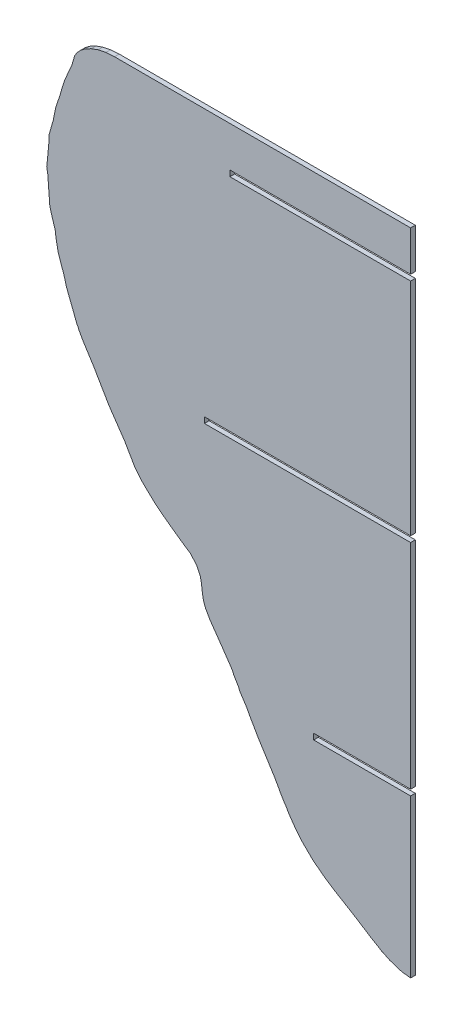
SolidWorks part; units mm, degrees
ref_plane "Спереди" through (0, 0, 0) normal (0, 0, 1) x (1, 0, 0)
ref_plane "Сверху" through (0, 0, 0) normal (0, 1, 0) x (1, 0, 0)
ref_plane "Справа" through (0, 0, 0) normal (1, 0, 0) x (0, 0, -1)
sketch "Model" plane through (0, 0, 0) normal (0, 0, 1) x (1, 0, 0)
  line L0 (-5553.9257, -52.95) -> (-5553.916, -52.9675)
  line L1 (-5553.916, -52.9675) -> (-5553.9072, -52.9834)
  line L2 (-5553.9072, -52.9834) -> (-5553.8984, -52.9993)
  line L3 (-5553.8984, -52.9993) -> (-5553.8896, -53.0151)
  line L4 (-5553.8896, -53.0151) -> (-5553.2595, -53.948)
  line L5 (-5553.2595, -53.948) -> (-5551.4807, -56.4991)
  line L6 (-5551.4807, -56.4991) -> (-5551.3896, -56.616)
  line L7 (-5551.3896, -56.616) -> (-5551.2983, -56.7328)
  line L8 (-5551.2983, -56.7328) -> (-5548.9946, -59.7252)
  line L9 (-5548.9946, -59.7252) -> (-5548.3706, -60.4646)
  line L10 (-5548.3706, -60.4646) -> (-5548.355, -60.4803)
  line L11 (-5548.355, -60.4803) -> (-5548.3496, -60.4855)
  line L12 (-5548.3496, -60.4855) -> (-5548.3105, -60.5317)
  line L13 (-5548.3105, -60.5317) -> (-5547.5281, -61.2947)
  line L14 (-5547.5281, -61.2947) -> (-5543.9182, -64.8505)
  line L15 (-5543.9182, -64.8505) -> (-5543.5627, -65.1965)
  line L16 (-5543.5627, -65.1965) -> (-5543.0049, -65.6568)
  line L17 (-5543.0049, -65.6568) -> (-5542.1001, -66.3395)
  line L18 (-5542.1001, -66.3395) -> (-5538.5322, -69.072)
  line L19 (-5538.5322, -69.072) -> (-5538.2622, -69.2579)
  line L20 (-5538.2622, -69.2579) -> (-5537.9922, -69.4437)
  line L21 (-5537.9922, -69.4437) -> (-5537.4724, -69.7801)
  line L22 (-5537.4724, -69.7801) -> (-5534.2546, -71.9145)
  line L23 (-5534.2546, -71.9145) -> (-5530.1741, -74.3404)
  line L24 (-5530.1741, -74.3404) -> (-5524.4228, -77.8417)
  line L25 (-5524.4228, -77.8417) -> (-5519.5566, -80.987)
  line L26 (-5519.5566, -80.987) -> (-5518.1645, -81.8527)
  line L27 (-5518.1645, -81.8527) -> (-5518.1201, -81.8767)
  line L28 (-5518.1201, -81.8767) -> (-5518.0757, -81.9007)
  line L29 (-5518.0757, -81.9007) -> (-5518.0315, -81.9247)
  line L30 (-5518.0315, -81.9247) -> (-5517.9871, -81.9487)
  line L31 (-5517.9871, -81.9487) -> (-5517.8228, -82.0496)
  line L32 (-5517.8228, -82.0496) -> (-5517.6584, -82.1503)
  line L33 (-5517.6584, -82.1503) -> (-5517.4985, -82.2342)
  line L34 (-5517.4985, -82.2342) -> (-5517.3386, -82.318)
  line L35 (-5517.3386, -82.318) -> (-5517.2012, -82.3906)
  line L36 (-5517.2012, -82.3906) -> (-5517.0637, -82.4631)
  line L37 (-5517.0637, -82.4631) -> (-5516.0979, -83.0245)
  line L38 (-5516.0979, -83.0245) -> (-5514.0706, -84.3211)
  line L39 (-5514.0706, -84.3211) -> (-5513.8103, -84.4079)
  line L40 (-5513.8103, -84.4079) -> (-5513.55, -84.4948)
  line L41 (-5513.55, -84.4948) -> (-5510.7139, -85.9042)
  line L42 (-5510.7139, -85.9042) -> (-5510.6553, -85.934)
  line L43 (-5510.6553, -85.934) -> (-5510.5964, -85.9637)
  line L44 (-5510.5964, -85.9637) -> (-5510.3667, -86.035)
  line L45 (-5510.3667, -86.035) -> (-5510.137, -86.1063)
  line L46 (-5510.137, -86.1063) -> (-5509.2903, -86.3835)
  line L47 (-5509.2903, -86.3835) -> (-5505.6423, -87.5591)
  line L48 (-5505.6423, -87.5591) -> (-5504.637, -87.7399)
  line L49 (-5504.637, -87.7399) -> (-5503.9382, -87.7903)
  line L50 (-5503.9382, -87.7903) -> (-5501.6404, -88.0699)
  line L51 (-5501.6404, -88.0699) -> (-5501.6404, -20.5677)
  line L52 (-5501.6404, -20.5677) -> (-5543.1523, -20.5677)
  line L53 (-5543.1523, -20.5677) -> (-5543.1523, -20.3177)
  line L54 (-5543.1523, -20.3177) -> (-5543.1523, -18.3177)
  line L55 (-5543.1523, -18.3177) -> (-5543.1523, -18.0677)
  line L56 (-5543.1523, -18.0677) -> (-5501.6404, -18.0677)
  line L57 (-5501.6404, -18.0677) -> (-5501.6404, 73.4017)
  line L58 (-5501.6404, 73.4017) -> (-5589.9341, 73.4017)
  line L59 (-5589.9341, 73.4017) -> (-5589.9341, 73.6517)
  line L60 (-5589.9341, 73.6517) -> (-5589.9341, 75.6517)
  line L61 (-5589.9341, 75.6517) -> (-5589.9341, 75.9017)
  line L62 (-5589.9341, 75.9017) -> (-5501.6404, 75.9017)
  line L63 (-5501.6404, 75.9017) -> (-5501.6404, 170.3516)
  line L64 (-5501.6404, 170.3516) -> (-5579.0183, 170.3516)
  line L65 (-5579.0183, 170.3516) -> (-5579.0183, 170.579)
  line L66 (-5579.0183, 170.579) -> (-5579.0183, 172.579)
  line L67 (-5579.0183, 172.579) -> (-5579.0183, 172.8516)
  line L68 (-5579.0183, 172.8516) -> (-5501.6404, 172.8516)
  line L69 (-5501.6404, 172.8516) -> (-5501.6404, 190.0592)
  line L70 (-5501.6404, 190.0592) -> (-5628.4258, 190.1311)
  line L71 (-5628.4258, 190.1311) -> (-5632.1106, 189.8824)
  line L72 (-5632.1106, 189.8824) -> (-5635.4304, 189.1919)
  line L73 (-5635.4304, 189.1919) -> (-5638.3535, 188.1436)
  line L74 (-5638.3535, 188.1436) -> (-5640.8486, 186.8212)
  line L75 (-5640.8486, 186.8212) -> (-5642.8845, 185.3084)
  line L76 (-5642.8845, 185.3084) -> (-5644.4297, 183.689)
  line L77 (-5644.4297, 183.689) -> (-5645.4526, 182.0467)
  line L78 (-5645.4526, 182.0467) -> (-5646.511, 178.4865)
  line L79 (-5646.511, 178.4865) -> (-5646.7537, 177.5711)
  line L80 (-5646.7537, 177.5711) -> (-5648.2297, 174.3211)
  line L81 (-5648.2297, 174.3211) -> (-5649.8113, 170.6813)
  line L82 (-5649.8113, 170.6813) -> (-5650.9299, 167.0724)
  line L83 (-5650.9299, 167.0724) -> (-5650.9321, 167.0647)
  line L84 (-5650.9321, 167.0647) -> (-5650.9343, 167.057)
  line L85 (-5650.9343, 167.057) -> (-5650.9363, 167.0493)
  line L86 (-5650.9363, 167.0493) -> (-5650.9385, 167.0417)
  line L87 (-5650.9385, 167.0417) -> (-5651.0217, 166.7809)
  line L88 (-5651.0217, 166.7809) -> (-5651.8367, 163.9394)
  line L89 (-5651.8367, 163.9394) -> (-5652.7607, 161.2404)
  line L90 (-5652.7607, 161.2404) -> (-5653.0933, 160.2906)
  line L91 (-5653.0933, 160.2906) -> (-5653.6787, 158.3007)
  line L92 (-5653.6787, 158.3007) -> (-5653.7058, 158.149)
  line L93 (-5653.7058, 158.149) -> (-5653.7332, 157.9972)
  line L94 (-5653.7332, 157.9972) -> (-5654.366, 154.8302)
  line L95 (-5654.366, 154.8302) -> (-5654.5496, 153.9366)
  line L96 (-5654.5496, 153.9366) -> (-5654.7334, 153.0428)
  line L97 (-5654.7334, 153.0428) -> (-5654.9348, 152.4994)
  line L98 (-5654.9348, 152.4994) -> (-5654.9585, 152.4157)
  line L99 (-5654.9585, 152.4157) -> (-5654.9822, 152.332)
  line L100 (-5654.9822, 152.332) -> (-5655.0166, 152.2376)
  line L101 (-5655.0166, 152.2376) -> (-5655.0513, 152.1432)
  line L102 (-5655.0513, 152.1432) -> (-5655.4878, 150.5501)
  line L103 (-5655.4878, 150.5501) -> (-5656.4294, 147.23)
  line L104 (-5656.4294, 147.23) -> (-5656.4438, 146.9292)
  line L105 (-5656.4438, 146.9292) -> (-5656.4582, 146.6285)
  line L106 (-5656.4582, 146.6285) -> (-5656.458, 146.6267)
  line L107 (-5656.458, 146.6267) -> (-5656.4578, 146.6249)
  line L108 (-5656.4578, 146.6249) -> (-5656.4622, 146.5386)
  line L109 (-5656.4622, 146.5386) -> (-5656.3625, 145.9525)
  line L110 (-5656.3625, 145.9525) -> (-5657.1309, 137.7478)
  line L111 (-5657.1309, 137.7478) -> (-5657.2251, 136.7743)
  line L112 (-5657.2251, 136.7743) -> (-5657.3196, 135.8007)
  line L113 (-5657.3196, 135.8007) -> (-5657.4492, 134.8204)
  line L114 (-5657.4492, 134.8204) -> (-5657.4482, 134.8146)
  line L115 (-5657.4482, 134.8146) -> (-5657.4478, 134.8117)
  line L116 (-5657.4478, 134.8117) -> (-5657.447, 134.8088)
  line L117 (-5657.447, 134.8088) -> (-5657.4475, 134.805)
  line L118 (-5657.4475, 134.805) -> (-5657.4482, 134.8011)
  line L119 (-5657.4482, 134.8011) -> (-5657.4492, 134.7934)
  line L120 (-5657.4492, 134.7934) -> (-5656.9805, 132.1648)
  line L121 (-5656.9805, 132.1648) -> (-5656.1113, 120.8204)
  line L122 (-5656.1113, 120.8204) -> (-5654.8765, 116.5286)
  line L123 (-5654.8765, 116.5286) -> (-5653.8384, 113.3779)
  line L124 (-5653.8384, 113.3779) -> (-5653.4121, 110.0677)
  line L125 (-5653.4121, 110.0677) -> (-5652.5168, 105.5138)
  line L126 (-5652.5168, 105.5138) -> (-5651.5073, 102.5451)
  line L127 (-5651.5073, 102.5451) -> (-5651.2888, 101.8879)
  line L128 (-5651.2888, 101.8879) -> (-5651.0701, 101.2308)
  line L129 (-5651.0701, 101.2308) -> (-5650.2598, 99.0715)
  line L130 (-5650.2598, 99.0715) -> (-5649.4951, 96.3724)
  line L131 (-5649.4951, 96.3724) -> (-5649.28, 95.5604)
  line L132 (-5649.28, 95.5604) -> (-5649.0649, 94.7484)
  line L133 (-5649.0649, 94.7484) -> (-5649.0093, 94.604)
  line L134 (-5649.0093, 94.604) -> (-5648.9534, 94.4595)
  line L135 (-5648.9534, 94.4595) -> (-5648.927, 94.3662)
  line L136 (-5648.927, 94.3662) -> (-5648.9006, 94.273)
  line L137 (-5648.9006, 94.273) -> (-5647.4136, 90.4251)
  line L138 (-5647.4136, 90.4251) -> (-5645.9595, 86.7167)
  line L139 (-5645.9595, 86.7167) -> (-5644.6628, 83.3692)
  line L140 (-5644.6628, 83.3692) -> (-5644.0706, 82.1503)
  line L141 (-5644.0706, 82.1503) -> (-5643.5137, 80.9746)
  line L142 (-5643.5137, 80.9746) -> (-5642.8044, 79.6431)
  line L143 (-5642.8044, 79.6431) -> (-5641.967, 78.1732)
  line L144 (-5641.967, 78.1732) -> (-5641.9607, 78.163)
  line L145 (-5641.9607, 78.163) -> (-5641.9543, 78.1528)
  line L146 (-5641.9543, 78.1528) -> (-5641.938, 78.1239)
  line L147 (-5641.938, 78.1239) -> (-5641.9216, 78.095)
  line L148 (-5641.9216, 78.095) -> (-5638.5063, 72.6757)
  line L149 (-5638.5063, 72.6757) -> (-5637.7131, 71.4158)
  line L150 (-5637.7131, 71.4158) -> (-5637.4958, 71.0792)
  line L151 (-5637.4958, 71.0792) -> (-5637.2786, 70.7426)
  line L152 (-5637.2786, 70.7426) -> (-5637.0884, 70.4131)
  line L153 (-5637.0884, 70.4131) -> (-5636.8979, 70.0836)
  line L154 (-5636.8979, 70.0836) -> (-5631.1887, 60.3224)
  line L155 (-5631.1887, 60.3224) -> (-5630.0537, 58.5599)
  line L156 (-5630.0537, 58.5599) -> (-5630.0508, 58.5556)
  line L157 (-5630.0508, 58.5556) -> (-5630.0452, 58.5468)
  line L158 (-5630.0452, 58.5468) -> (-5630.0393, 58.5381)
  line L159 (-5630.0393, 58.5381) -> (-5630.0281, 58.5206)
  line L160 (-5630.0281, 58.5206) -> (-5629.8733, 58.2958)
  line L161 (-5629.8733, 58.2958) -> (-5629.8215, 58.2208)
  line L162 (-5629.8215, 58.2208) -> (-5624.0552, 49.7976)
  line L163 (-5624.0552, 49.7976) -> (-5623.9019, 49.5236)
  line L164 (-5623.9019, 49.5236) -> (-5623.7485, 49.2495)
  line L165 (-5623.7485, 49.2495) -> (-5622.3557, 46.8379)
  line L166 (-5622.3557, 46.8379) -> (-5619.8931, 42.6358)
  line L167 (-5619.8931, 42.6358) -> (-5619.4536, 41.9365)
  line L168 (-5619.4536, 41.9365) -> (-5619.0059, 41.3799)
  line L169 (-5619.0059, 41.3799) -> (-5616.4141, 38.3178)
  line L170 (-5616.4141, 38.3178) -> (-5613.9075, 35.8834)
  line L171 (-5613.9075, 35.8834) -> (-5610.9761, 33.1492)
  line L172 (-5610.9761, 33.1492) -> (-5608.2405, 30.9581)
  line L173 (-5608.2405, 30.9581) -> (-5605.281, 28.7655)
  line L174 (-5605.281, 28.7655) -> (-5605.0991, 28.6228)
  line L175 (-5605.0991, 28.6228) -> (-5604.917, 28.4958)
  line L176 (-5604.917, 28.4958) -> (-5604.3252, 28.0574)
  line L177 (-5604.3252, 28.0574) -> (-5598.8289, 24.1556)
  line L178 (-5598.8289, 24.1556) -> (-5595.99, 22.2505)
  line L179 (-5595.99, 22.2505) -> (-5595.4299, 21.6608)
  line L180 (-5595.4299, 21.6608) -> (-5593.353, 19.2774)
  line L181 (-5593.353, 19.2774) -> (-5592.3154, 17.3077)
  line L182 (-5592.3154, 17.3077) -> (-5592.0061, 16.6149)
  line L183 (-5592.0061, 16.6149) -> (-5591.6968, 15.922)
  line L184 (-5591.6968, 15.922) -> (-5591.2185, 13.5299)
  line L185 (-5591.2185, 13.5299) -> (-5590.7874, 10.1681)
  line L186 (-5590.7874, 10.1681) -> (-5590.3989, 7.8723)
  line L187 (-5590.3989, 7.8723) -> (-5590.1492, 6.9541)
  line L188 (-5590.1492, 6.9541) -> (-5589.3735, 4.9349)
  line L189 (-5589.3735, 4.9349) -> (-5589.0977, 4.4838)
  line L190 (-5589.0977, 4.4838) -> (-5588.8215, 4.0326)
  line L191 (-5588.8215, 4.0326) -> (-5587.6433, 1.9192)
  line L192 (-5587.6433, 1.9192) -> (-5582.5945, -5.3186)
  line L193 (-5582.5945, -5.3186) -> (-5582.0525, -6.0787)
  line L194 (-5582.0525, -6.0787) -> (-5582.0044, -6.1642)
  line L195 (-5582.0044, -6.1642) -> (-5581.9563, -6.2495)
  line L196 (-5581.9563, -6.2495) -> (-5578.1316, -11.8418)
  line L197 (-5578.1316, -11.8418) -> (-5577.7512, -12.6802)
  line L198 (-5577.7512, -12.6802) -> (-5577.324, -13.5854)
  line L199 (-5577.324, -13.5854) -> (-5575.3962, -16.8573)
  line L200 (-5575.3962, -16.8573) -> (-5575.032, -17.6658)
  line L201 (-5575.032, -17.6658) -> (-5574.6677, -18.4741)
  line L202 (-5574.6677, -18.4741) -> (-5572.5835, -21.6929)
  line L203 (-5572.5835, -21.6929) -> (-5571.9055, -22.7104)
  line L204 (-5571.9055, -22.7104) -> (-5570.2615, -25.7633)
  line L205 (-5570.2615, -25.7633) -> (-5566.7637, -31.8572)
  line L206 (-5566.7637, -31.8572) -> (-5562.6536, -38.3485)
  line L207 (-5562.6536, -38.3485) -> (-5559.9673, -42.6245)
  line L208 (-5559.9673, -42.6245) -> (-5558.5049, -45.2013)
  line L209 (-5558.5049, -45.2013) -> (-5556.9773, -47.9975)
  line L210 (-5556.9773, -47.9975) -> (-5555.9053, -49.7475)
  line L211 (-5555.9053, -49.7475) -> (-5555.8994, -49.756)
  line L212 (-5555.8994, -49.756) -> (-5555.8936, -49.7644)
  line L213 (-5555.8936, -49.7644) -> (-5555.8879, -49.7728)
  line L214 (-5555.8879, -49.7728) -> (-5555.8821, -49.7812)
  line L215 (-5555.8821, -49.7812) -> (-5555.8745, -49.7936)
  line L216 (-5555.8745, -49.7936) -> (-5555.8669, -49.806)
  line L217 (-5555.8669, -49.806) -> (-5555.8596, -49.8183)
  line L218 (-5555.8596, -49.8183) -> (-5555.852, -49.8307)
  line L219 (-5555.852, -49.8307) -> (-5555.4004, -50.4873)
  line L220 (-5555.4004, -50.4873) -> (-5554.9487, -51.1439)
  line L221 (-5554.9487, -51.1439) -> (-5554.675, -51.6147)
  line L222 (-5554.675, -51.6147) -> (-5554.4011, -52.0855)
  line L223 (-5554.4011, -52.0855) -> (-5554.1882, -52.4724)
  line L224 (-5554.1882, -52.4724) -> (-5553.9753, -52.8594)
  line L225 (-5553.9753, -52.8594) -> (-5553.9634, -52.8816)
  line L226 (-5553.9634, -52.8816) -> (-5553.9512, -52.9039)
  line L227 (-5553.9512, -52.9039) -> (-5553.939, -52.9261)
  line L228 (-5553.939, -52.9261) -> (-5553.9257, -52.95)
extrude "Бобышка-Вытянуть1" add sketch "Model" along normal blind 2
